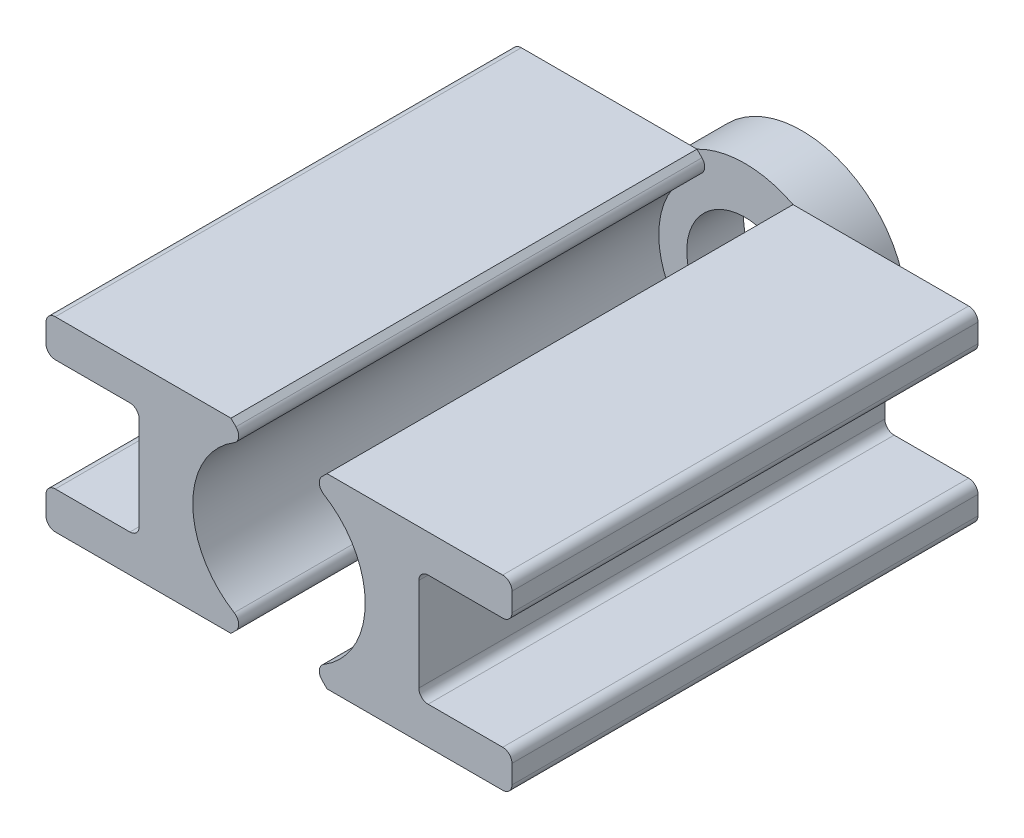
SolidWorks part; units mm, degrees
ref_plane "Top Plane" through (0, 0, 0) normal (0, 0, 1) x (1, 0, 0)
ref_plane "Front Plane" through (0, 0, 0) normal (0, 1, 0) x (1, 0, 0)
ref_plane "Right Plane" through (0, 0, 0) normal (1, 0, 0) x (0, 0, -1)
sketch "Sketch1" plane through (0, 0, 0) normal (0, 0, 1) x (1, 0, 0)
  circle A0 centre (0, 0) radius 12.5
  circle A1 centre (0, 0) radius 22.5
extrude "Boss-Extrude1" add sketch "Sketch1" along normal blind 12.2
sketch "Sketch2" plane through (0, 0, 12.2) normal (0, 0, 1) x (1, 0, 0)
  line L0 (0, 70.9915) -> (0, -70.9915) construction
  line L1 (-48, 20) -> (-10.3078, 20)
  line L2 (-50, 18) -> (-50, 14)
  line L3 (-48, -20) -> (-10.3078, -20)
  line L5 (-50, -14) -> (-50, -18)
  line L6 (-10.3078, 20) -> (-10.3078, 0) construction
  line L7 (-94.8251, 0) -> (94.8251, 0) construction
  line L8 (-10.3078, 0) -> (-10.3078, -20) construction
  line L9 (-48, 12) -> (-32, 12)
  line L11 (-48, -12) -> (-32, -12)
  line L12 (-30, 10) -> (-30, -10)
  line L13 (-10.3078, 20) -> (-9.2375, 18.9297)
  line L14 (-10.3078, -20) -> (-9.2375, -18.9297)
  line L15 (48, 20) -> (10.3078, 20)
  line L16 (48, -20) -> (10.3078, -20)
  line L17 (30, 10) -> (30, -10)
  line L18 (50, -14) -> (50, -18)
  line L19 (48, -12) -> (32, -12)
  line L20 (48, 12) -> (32, 12)
  line L21 (50, 18) -> (50, 14)
  line L22 (10.3078, -20) -> (9.2375, -18.9297)
  line L23 (10.3078, 20) -> (9.2375, 18.9297)
  circle A0 centre (0, 0) radius 12.5 construction
  circle A1 centre (0, 0) radius 22.5 construction
  circle A2 centre (0, 0) radius 12.5 construction
  circle A3 centre (0, 0) radius 22.5 construction
  arc A4 (-50, -18) -> (-48, -20) centre (-48, -18) ccw
  arc A5 (-50, -14) -> (-48, -12) centre (-48, -14) cw
  arc A6 (-50, 14) -> (-48, 12) centre (-48, 14) ccw
  arc A7 (-50, 18) -> (-48, 20) centre (-48, 18) cw
  arc A8 (-32, 12) -> (-30, 10) centre (-32, 10) cw
  arc A9 (-30, -10) -> (-32, -12) centre (-32, -10) cw
  arc A10 (-9.6125, 15.8067) -> (-9.6125, -15.8067) centre (0, 0) ccw
  arc A11 (30, -10) -> (32, -12) centre (32, -10) ccw
  arc A12 (32, 12) -> (30, 10) centre (32, 10) ccw
  arc A13 (50, -18) -> (48, -20) centre (48, -18) cw
  arc A14 (50, 18) -> (48, 20) centre (48, 18) ccw
  arc A15 (50, 14) -> (48, 12) centre (48, 14) cw
  arc A16 (50, -14) -> (48, -12) centre (48, -14) ccw
  circle A17 centre (0, 0) radius 18.5 construction
  arc A18 (9.6125, -15.8067) -> (9.6125, 15.8067) centre (0, 0) ccw
  arc A19 (9.2375, 18.9297) -> (9.6125, 15.8067) centre (10.6517, 17.5155) ccw
  arc A20 (9.6125, -15.8067) -> (9.2375, -18.9297) centre (10.6517, -17.5155) ccw
  arc A21 (-9.2375, -18.9297) -> (-9.6125, -15.8067) centre (-10.6517, -17.5155) ccw
  arc A22 (-9.6125, 15.8067) -> (-9.2375, 18.9297) centre (-10.6517, 17.5155) ccw
  point P12 (0, 0)
  point P15 (0, 0)
  point P23 (-50, -20)
  point P29 (-50, 12)
  point P32 (-50, 20)
  point P35 (-30, 12)
  point P38 (-30, -12)
  point P54 (30, -12)
  point P55 (30, 12)
  point P56 (50, -20)
  point P64 (50, 20)
  point P65 (50, 12)
  point P70 (7.3046, 16.9968)
  point P73 (7.3046, -16.9968)
  point P76 (-7.3046, -16.9968)
  point P79 (-7.3046, 16.9968)
extrude "Boss-Extrude2" add sketch "Sketch2" along normal blind 100
equation "\"bore-id\"= 25mm"
equation "\"wall-thickness\"= 8mm"
equation "\"wall-depth\"= 4mm"
equation "\"bolt-size\" = 4.2mm"
equation "\"jaw-spread\" = 100mm"
equation "\"jaw-width\"= 20mm"
equation "\"jaw-distance\"= 100mm"
equation "\"D2@Sketch1\"=\"bore-id\""
equation "\"D1@Boss-Extrude1\"= \"wall-depth\" + \"bolt-size\" + \"wall-depth\""
equation "\"D2@Sketch2\" = \"jaw-width\" + \"wall-thickness\" + \"wall-thickness\" + 2 * \"radius\""
equation "\"D3@Sketch2\"= \"jaw-width\" + 2 * \"radius\""
equation "\"radius\" = 2mm"
equation "\"D1@Sketch2\"=\"jaw-spread\"/2"
equation "\"D6@Sketch2\"= \"radius\""
equation "\"D5@Sketch2\"= \"radius\""
equation "\"D7@Sketch2\"= \"wall-thickness\" / 2"
equation "\"D10@Sketch2\"= \"radius\""
equation "\"D1@Boss-Extrude2\"= \"jaw-distance\""
